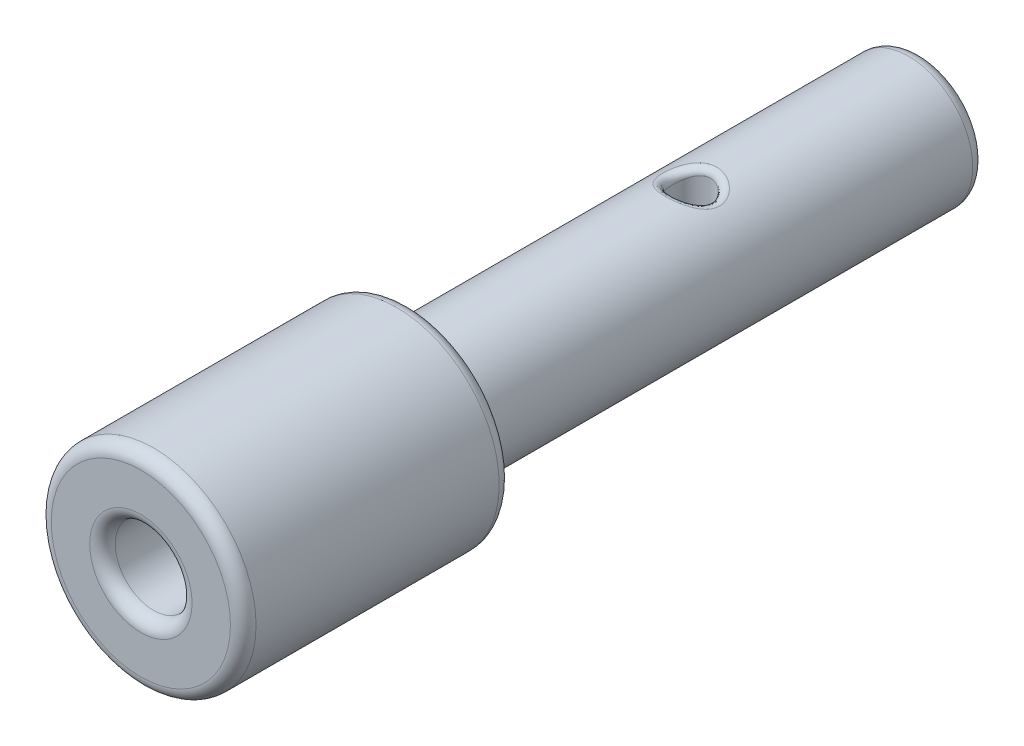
SolidWorks part; units mm, degrees
ref_plane "Спереди" through (0, 0, 0) normal (0, 0, 1) x (1, 0, 0)
ref_plane "Сверху" through (0, 0, 0) normal (0, 1, 0) x (1, 0, 0)
ref_plane "Справа" through (0, 0, 0) normal (1, 0, 0) x (0, 0, -1)
sketch "Эскиз1" plane through (0, 0, 0) normal (1, 0, 0) x (0, 0, -1)
  line L0 (0, 1.5) -> (12, 1.5)
  line L1 (12, 1.5) -> (12, 0)
  line L2 (12, 0) -> (30.5, 0)
  line L3 (30.5, 0) -> (30.5, 2.5)
  line L4 (30.5, 2.5) -> (10.5, 2.5)
  line L5 (10.5, 2.5) -> (10.5, 4)
  line L6 (10.5, 4) -> (0, 4)
  line L7 (0, 4) -> (0, 1.5)
  line L8 (0, 0) -> (30.5, 0) construction
  dimension "D1" = 3
  dimension "D2" = 5
  dimension "D3" = 8
  dimension "D4" = 12
  dimension "D5" = 10.5
  dimension "D6" = 20
revolve "Повернуть1" add sketch "Эскиз1" angle 360 about L8
fillet "Скругление1" radius 0.5 6 edges at (2.5, 0, -30.5) (2.5, 0, -10.5) (1.5, 0, 0) (1.5, 0, -12) (4, 0, -10.5) (4, 0, 0)
sketch "Эскиз2" plane through (0, 0, 0) normal (0, 1, 0) x (1, 0, 0)
  line L0 (3.5, 10.5) -> (-3.5, 10.5) construction
  circle A0 centre (0, 21.5) radius 0.75
  dimension "D1" = 1.5
  dimension "D2" = 11
extrude "Вырез-Вытянуть1" cut sketch "Эскиз2" against normal mid plane 10
fillet "Скругление2" radius 0.25 2 edges at (-0.1357, -2.4963, -22.2376) (0.1357, 2.4963, -22.2376)
